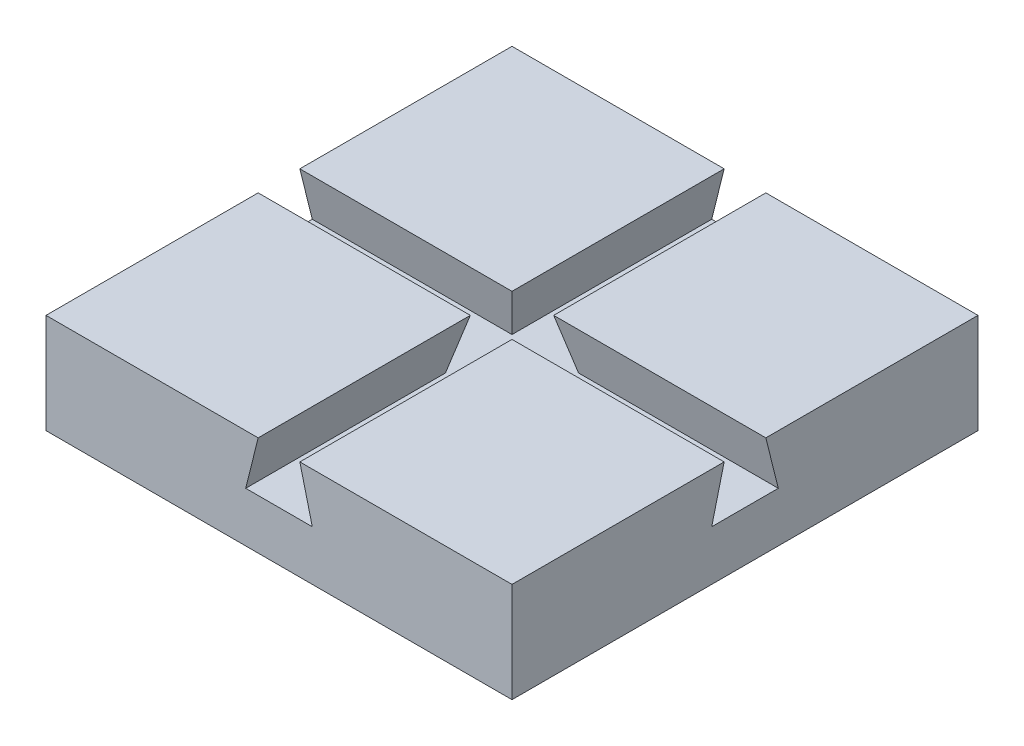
SolidWorks part; units mm, degrees
ref_plane "Front" through (0, 0, 0) normal (0, 0, 1) x (1, 0, 0)
ref_plane "Top" through (0, 0, 0) normal (0, 1, 0) x (1, 0, 0)
ref_plane "Right" through (0, 0, 0) normal (1, 0, 0) x (0, 0, -1)
other "Configuration Table"
sketch "Sketch1" plane through (0, 0, 0) normal (0, 1, 0) x (1, 0, 0)
  line L0 (-44.45, -44.45) -> (44.45, -44.45)
  line L1 (-44.45, -44.45) -> (-44.45, 44.45)
  line L2 (44.45, 44.45) -> (-44.45, 44.45)
  line L3 (44.45, 44.45) -> (44.45, -44.45)
  line L4 (-44.45, -44.45) -> (44.45, 44.45) construction
  dimension "D1" = 88.9
extrude "Base-Extrude" add sketch "Sketch1" along normal blind 19.05
sketch "Sketch2" plane through (0, 0, 44.45) normal (0, 0, 1) x (1, 0, 0)
  line L0 (0, -6.2714) -> (0, 26.7115) construction
  line L1 (6.35, 9.525) -> (-6.35, 9.525)
  line L2 (-6.35, 9.525) -> (-3.9752, 19.05)
  line L3 (-44.45, 19.05) -> (44.45, 19.05) construction
  line L4 (6.35, 9.525) -> (3.9752, 19.05)
  line L5 (-3.9752, 19.05) -> (3.9752, 19.05)
  point P6 (0, 9.525)
  point P11 (0, 19.05)
  dimension "D1" = 28
  dimension "D2" = 9.525
  dimension "D3" = 12.7
extrude "Cut-Extrude1" cut sketch "Sketch2" against normal through all
sketch "Sketch3" plane through (44.45, -3.5382, -0.6646) normal (1, 0, 0) x (0, 0, -1)
  line L0 (-0.6646, -6.2714) -> (-0.6646, 26.7115) construction
  line L1 (5.6854, 13.0632) -> (-7.0146, 13.0632)
  line L2 (-7.0146, 13.0632) -> (-4.6397, 22.5882)
  line L3 (43.7854, 22.5882) -> (-45.1146, 22.5882) construction
  line L4 (5.6854, 13.0632) -> (3.3106, 22.5882)
  line L5 (-4.6397, 22.5882) -> (3.3106, 22.5882)
  point P6 (-0.6646, 13.0632)
  point P11 (-0.6646, 22.5882)
  dimension "D1" = 28
  dimension "D2" = 9.525
  dimension "D3" = 12.7
extrude "Cut-Extrude2" cut sketch "Sketch3" against normal through all
